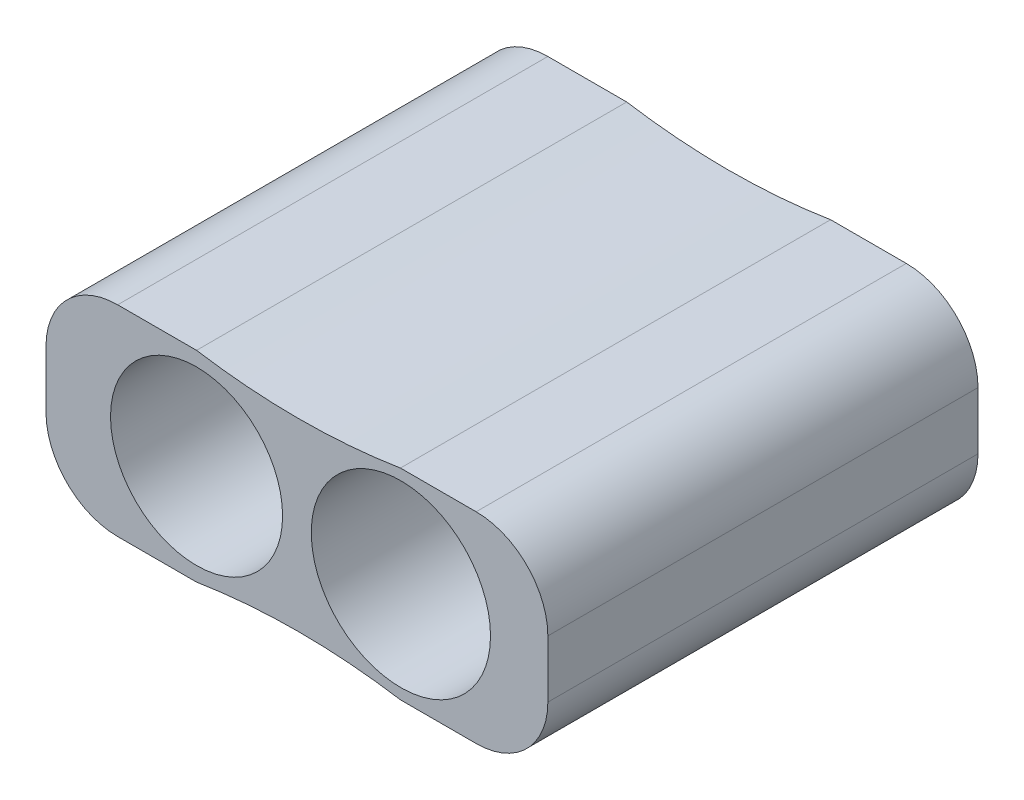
SolidWorks part; units mm, degrees
ref_plane "Alzado" through (0, 0, 0) normal (0, 0, 1) x (1, 0, 0)
ref_plane "Planta" through (0, 0, 0) normal (0, 1, 0) x (1, 0, 0)
ref_plane "Vista lateral" through (0, 0, 0) normal (1, 0, 0) x (0, 0, -1)
sketch "Croquis1" plane through (0, 0, 0) normal (0, 0, 1) x (1, 0, 0)
  line L0 (-7, 0) -> (7.25, 0) construction
  line L1 (-1, 0) -> (1, 0)
  line L3 (-17.5, 7) -> (17.5, 7)
  line L4 (-17.5, 7) -> (-17.5, -7)
  line L5 (-17.5, -7) -> (17.5, -7)
  line L6 (17.5, 7) -> (17.5, -7)
  line L7 (-17.5, 7) -> (17.5, -7) construction
  line L8 (-17.5, -7) -> (17.5, 7) construction
  circle A0 centre (-7, 0) radius 6
  circle A1 centre (7.25, 0) radius 6.25
  point P5 (1, 0)
  point P6 (-1, 0)
  point P9 (0, 0)
  point P10 (0, 0)
  dimension "D1" = 12
  dimension "D2" = 12.5
  dimension "D3" = 2
  dimension "D4" = 14
  dimension "D5" = 35
extrude "Saliente-Extruir1" add sketch "Croquis1" along normal blind 15
sketch "Croquis2" plane through (0, 0, 0) normal (0, 0, -1) x (-1, 0, 0)
  line L1 (-17.5, 7) -> (17.5, 7)
  line L2 (-17.5, 7) -> (-17.5, -7)
  line L3 (-17.5, -7) -> (17.5, -7)
  line L4 (17.5, 7) -> (17.5, -7)
  line L5 (-17.5, 7) -> (17.5, -7) construction
  line L6 (-17.5, -7) -> (17.5, 7) construction
  line L7 (12, 0) -> (-12.22, 0) construction
  circle A0 centre (-7.22, 0) radius 5
  circle A1 centre (7, 0) radius 5
  point P0 (0, 0)
  point P14 (-2.22, 0)
  point P15 (2, 0)
  dimension "D1" = 10
  dimension "D2" = 10
  dimension "D3" = 4.22
extrude "Saliente-Extruir2" add sketch "Croquis2" along normal blind 15
sketch "Croquis3" plane through (0, 0, -15) normal (0, 0, -1) x (-1, 0, 0)
  line L0 (-17.5, 7) -> (-17.5, -7)
  line L1 (17.5, 7) -> (17.5, -7)
  line L3 (17.5, 7) -> (-17.5, 7) construction
  line L4 (-7.22, 5) -> (-7.22, 7) construction
  line L5 (7, 5) -> (7, 7) construction
  line L6 (-17.5, 0) -> (17.5, 0) construction
  line L7 (-7.22, -7) -> (7, -7)
  line L8 (-7.22, 7) -> (7, 7)
  circle A0 centre (-7.22, 0) radius 5 construction
  circle A1 centre (7, 0) radius 5 construction
  arc A2 (-7.22, 7) -> (7, 7) centre (-0.11, 51.4348) ccw
  arc A3 (-7.22, -7) -> (7, -7) centre (-0.11, -51.4348) cw
  spline S0 degree 2 poles (-17.5, 7) (0, 7) (17.5, 7) knots 0 0 0 1 1 1
  dimension "D1" = 45
extrude "Cortar-Extruir2" cut sketch "Croquis3" against normal through all contours A2 M3 | A3 M5
fillet "Redondeo1" radius 5 4 edges at (17.5, -7, 0) (-17.5, -7, 0) (-17.5, 7, 0) (17.5, 7, 0)
